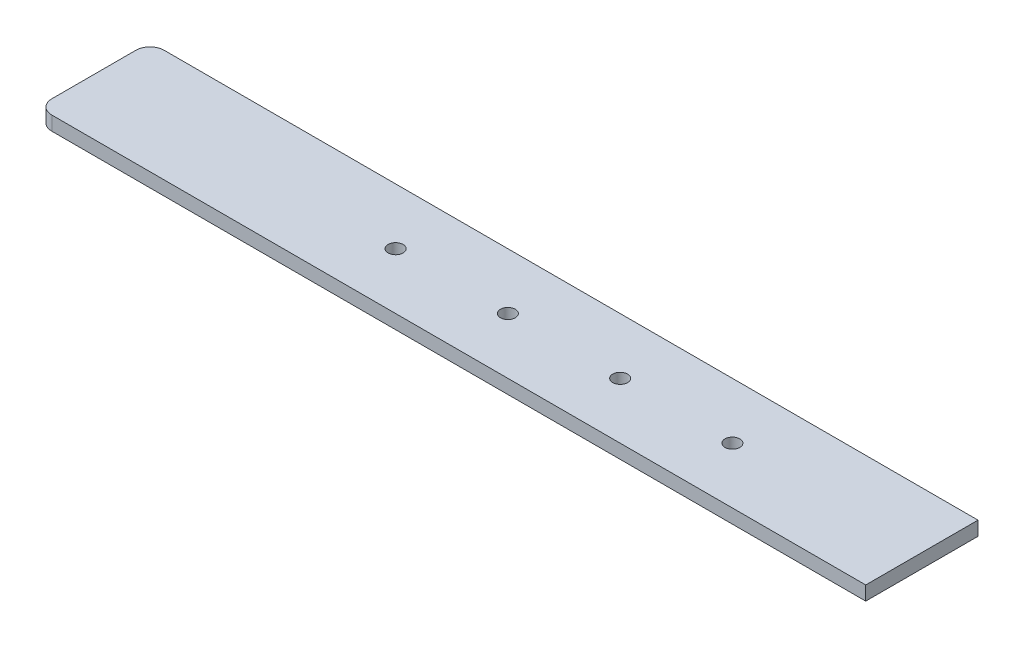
SolidWorks part; units mm, degrees
ref_plane "Front Plane" through (0, 0, 0) normal (0, 0, 1) x (1, 0, 0)
ref_plane "Top Plane" through (0, 0, 0) normal (0, 1, 0) x (1, 0, 0)
ref_plane "Right Plane" through (0, 0, 0) normal (1, 0, 0) x (0, 0, -1)
sketch "Sketch1" plane through (0, 0, 0) normal (0, 1, 0) x (1, 0, 0)
  line L1 (-187.325, -25.4) -> (187.325, -25.4)
  line L2 (-187.325, -25.4) -> (-187.325, 25.4)
  line L3 (-187.325, 25.4) -> (187.325, 25.4)
  line L4 (187.325, -25.4) -> (187.325, 25.4)
  dimension "D1" = 50.8
  dimension "D2" = 25.4
  dimension "D3" = 374.65
  dimension "D4" = 187.325
extrude "Boss-Extrude1" add sketch "Sketch1" against normal blind 6.35
sketch "Sketch2" plane through (0, 0, 0) normal (0, 1, 0) x (1, 0, 0)
  line L2 (187.325, -25.4) -> (187.325, 25.4) construction
  circle A0 centre (-50.8, 0) radius 3.3655
  circle A1 centre (0, 0) radius 3.3655
  circle A2 centre (50.8, 0) radius 3.3655
  circle A3 centre (101.6, 0) radius 3.3655
  dimension "D1" = 6.731
  dimension "D2" = 6.731
  dimension "D5" = 50.8
  dimension "D3" = 85.725
  dimension "D4" = 50.8
  dimension "D6" = 50.8
extrude "Cut-Extrude1" cut sketch "Sketch2" against normal through all
fillet "Fillet1" radius 6.35 2 edges at (-187.325, -3.175, -25.4) (-187.325, -3.175, 25.4)
